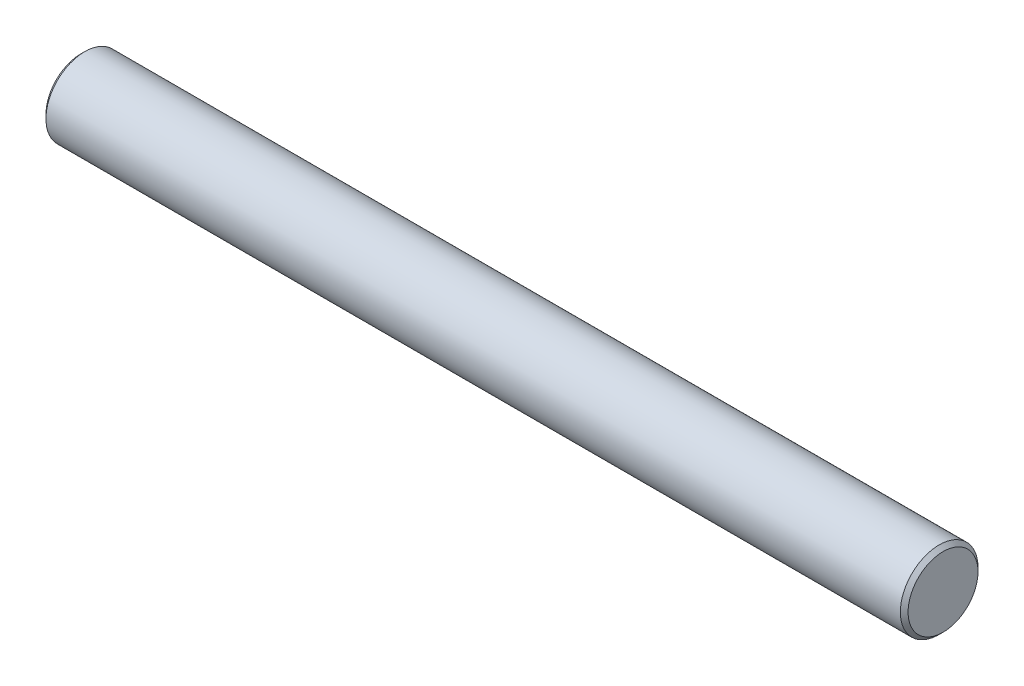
SolidWorks part; units mm, degrees
ref_plane "Front" through (0, 0, 0) normal (0, 0, 1) x (1, 0, 0)
ref_plane "Top" through (0, 0, 0) normal (0, 1, 0) x (1, 0, 0)
ref_plane "Right" through (0, 0, 0) normal (1, 0, 0) x (0, 0, -1)
sketch "Sketch1" plane through (0, 0, 0) normal (1, 0, 0) x (0, 0, -1)
  circle A0 centre (0, 0) radius 10
  dimension "D1" = 20
extrude "Extrude1" add sketch "Sketch1" along normal blind 222
chamfer "Chamfer1" distance 1 angle 45 2 edges at (0, 0, -10) (222, 0, -10)
